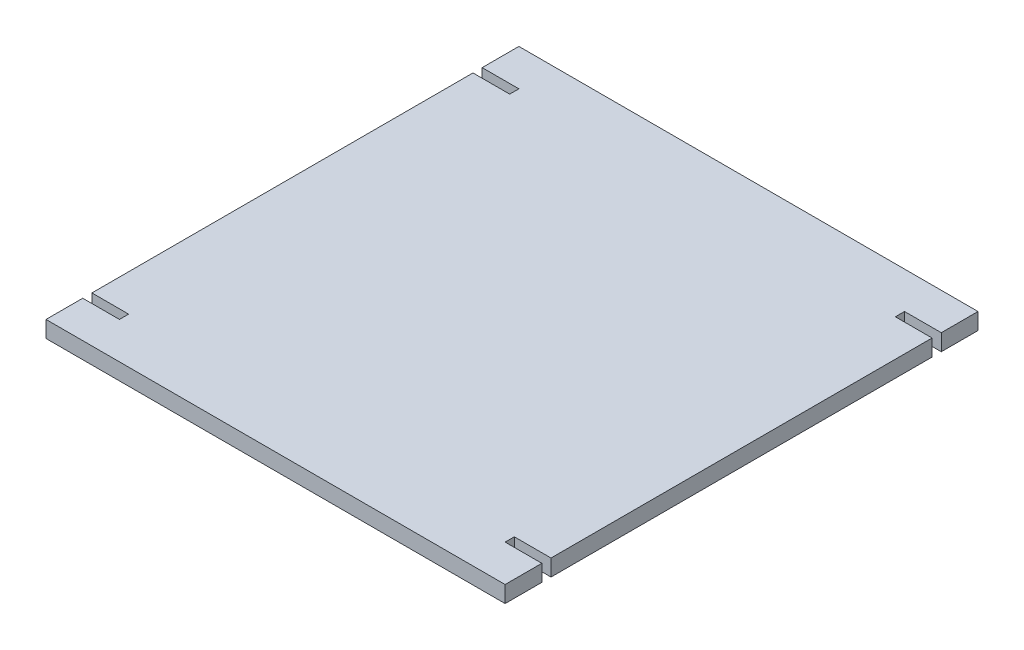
SolidWorks part; units mm, degrees
ref_plane "Front Plane" through (0, 0, 0) normal (0, 0, 1) x (1, 0, 0)
ref_plane "Top Plane" through (0, 0, 0) normal (0, 1, 0) x (1, 0, 0)
ref_plane "Right Plane" through (0, 0, 0) normal (1, 0, 0) x (0, 0, -1)
sketch "Sketch1" plane through (0, 0, 0) normal (0, 1, 0) x (1, 0, 0)
  line L0 (-301.875, 208.2292) -> (198.125, 208.2292)
  line L1 (198.125, 208.2292) -> (198.125, 168.2292)
  line L2 (198.125, 168.2292) -> (158.125, 168.2292)
  line L3 (158.125, 168.2292) -> (158.125, 158.2292)
  line L4 (158.125, 158.2292) -> (198.125, 158.2292)
  line L5 (198.125, 158.2292) -> (198.125, -256.7708)
  line L6 (198.125, -256.7708) -> (158.125, -256.7708)
  line L7 (158.125, -256.7708) -> (158.125, -266.7708)
  line L8 (158.125, -266.7708) -> (198.125, -266.7708)
  line L9 (198.125, -266.7708) -> (198.125, -306.7708)
  line L10 (198.125, -306.7708) -> (-301.875, -306.7708)
  line L11 (-301.875, -306.7708) -> (-301.875, -266.7708)
  line L12 (-301.875, -266.7708) -> (-261.875, -266.7708)
  line L13 (-261.875, -266.7708) -> (-261.875, -256.7708)
  line L14 (-261.875, -256.7708) -> (-301.875, -256.7708)
  line L15 (-301.875, -256.7708) -> (-301.875, 158.2292)
  line L16 (-301.875, 158.2292) -> (-261.875, 158.2292)
  line L17 (-261.875, 158.2292) -> (-261.875, 168.2292)
  line L18 (-261.875, 168.2292) -> (-301.875, 168.2292)
  line L19 (-301.875, 168.2292) -> (-301.875, 208.2292)
  point P18 (-281.875, -266.7708)
  dimension "D1" = 10
  dimension "D2" = 40
  dimension "D3" = 40
  dimension "D4" = 515
  dimension "D5" = 500
  dimension "D6" = 40
extrude "Boss-Extrude1" add sketch "Sketch1" along normal blind 18
